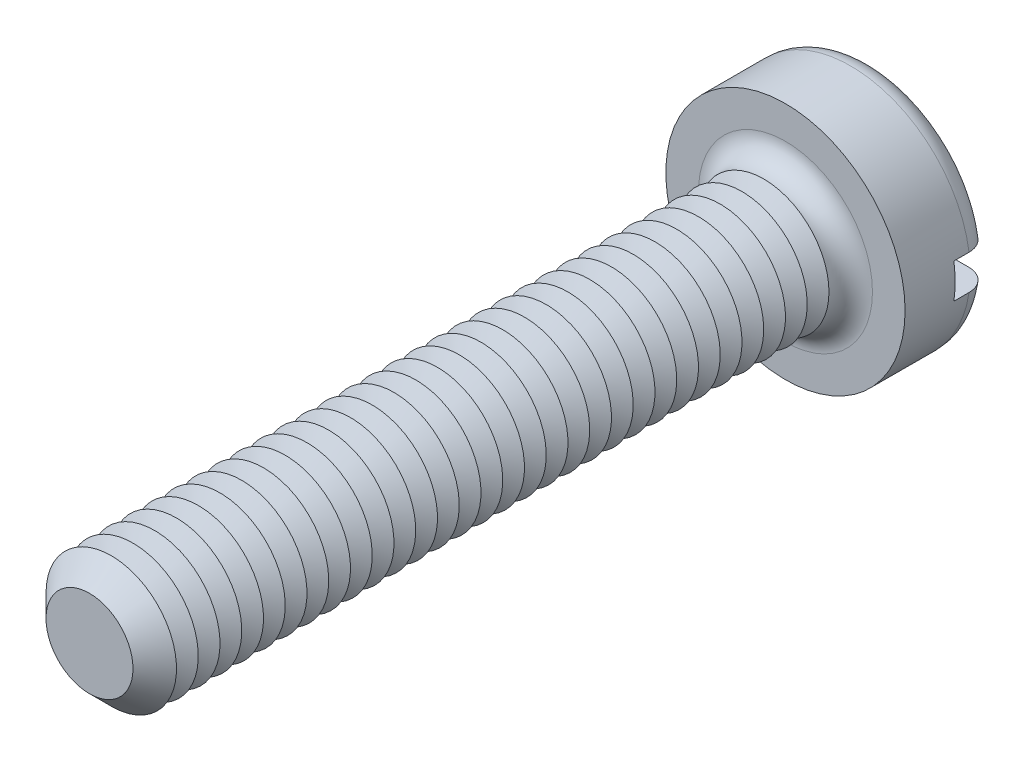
SolidWorks part; units mm, degrees
ref_plane "Front Plane" through (0, 0, 0) normal (0, 0, 1) x (1, 0, 0)
ref_plane "Top Plane" through (0, 0, 0) normal (0, 1, 0) x (1, 0, 0)
ref_plane "Right Plane" through (0, 0, 0) normal (1, 0, 0) x (0, 0, -1)
sketch "Sketch3" plane through (0, 0, 0) normal (0, 0, 1) x (1, 0, 0)
  circle A0 centre (0, 0) radius 2.75
  dimension "D1" = 5.5
extrude "Boss-Extrude2" add sketch "Sketch3" against normal blind 2
sketch "Sketch4" plane through (0, 0, 0) normal (0, 0, 1) x (1, 0, 0)
  circle A0 centre (0, 0) radius 1.5
  dimension "D1" = 3
extrude "Boss-Extrude3" add sketch "Sketch4" along normal blind 16
fillet "Fillet1" radius 0.5 2 edges at (2.75, 0, -2) (1.5, 0, 0)
chamfer "Chamfer1" distance 0.5 angle 45 1 edges at (1.5, 0, 16)
sketch "Sketch5" plane through (0, 0, 0) normal (1, 0, 0) x (0, 0, -1)
  line L0 (1.6944, 0) -> (-7.6738, 0) construction
sketch "Sketch6" plane through (0, 0, 0) normal (1, 0, 0) x (0, 0, -1)
  line L0 (-0.5, 1.5) -> (-0.75, 1.067)
  line L1 (-0.75, 1.067) -> (-1, 1.5)
  line L2 (-0.5, 1.5) -> (-15.5, 1.5) construction
  line L3 (-1, 1.5) -> (-0.5, 1.5)
  dimension "D1" = 0.5
revolve "Cut-Revolve1" cut sketch "Sketch6" angle 360 about L0
pattern_linear "LPattern1" count 30 spacing 0.5 along (0, 0, 1) of "Cut-Revolve1"
sketch "Sketch8" plane through (0, 0, -2) normal (0, 0, -1) x (-1, 0, 0)
  line L1 (2.75, -0.4) -> (-2.75, -0.4)
  line L2 (2.75, -0.4) -> (2.75, 0.4)
  line L3 (2.75, 0.4) -> (-2.75, 0.4)
  line L4 (-2.75, -0.4) -> (-2.75, 0.4)
  line L5 (2.75, -0.4) -> (-2.75, 0.4) construction
  line L6 (2.75, 0.4) -> (-2.75, -0.4) construction
  point P0 (0, 0)
  dimension "D1" = 5.5
  dimension "D2" = 0.8
extrude "Cut-Extrude1" cut sketch "Sketch8" against normal blind 0.85
